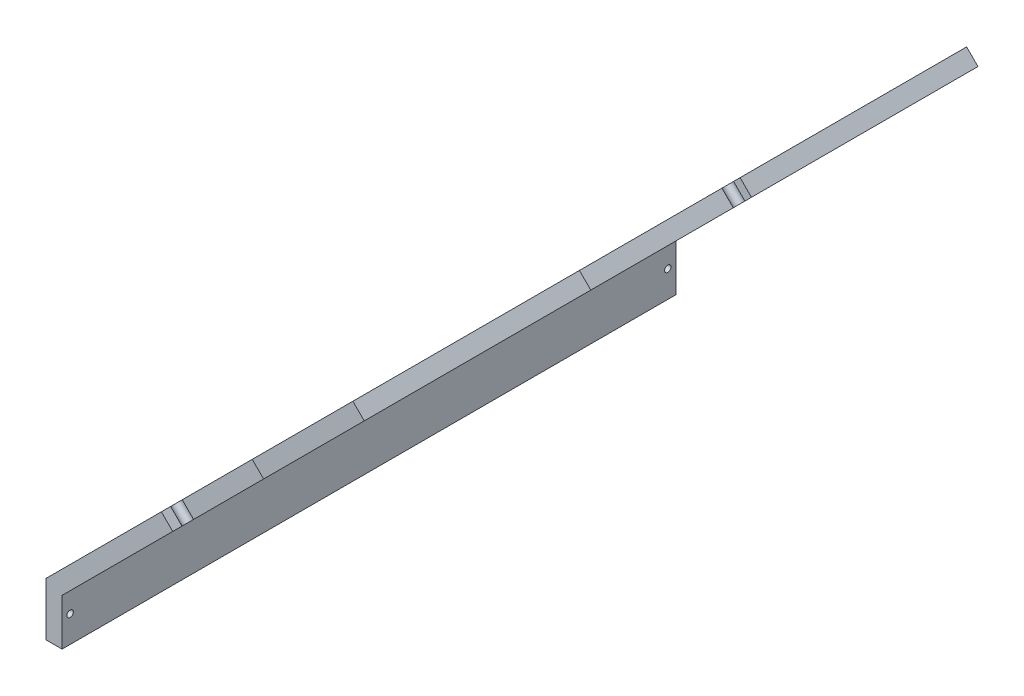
SolidWorks part; units mm, degrees
ref_plane "Plan de face" through (0, 0, 0) normal (0, 0, 1) x (1, 0, 0)
ref_plane "Plan de dessus" through (0, 0, 0) normal (0, 1, 0) x (1, 0, 0)
ref_plane "Plan de droite" through (0, 0, 0) normal (1, 0, 0) x (0, 0, -1)
sketch "Esquisse1" plane through (0, 0, 0) normal (0, 0, 1) x (1, 0, 0)
  line L0 (0, 0) -> (-5, 0)
  line L1 (-5, 0) -> (-5, 16.5711)
  line L2 (-5, 16.5711) -> (90.5026, 112.0737)
  line L3 (90.5026, 112.0737) -> (94.0381, 108.5381)
  line L4 (94.0381, 108.5381) -> (0, 14.5)
  line L5 (0, 14.5) -> (0, 0)
  dimension "D1" = 5
  dimension "D2" = 5
  dimension "D3" = 135
  dimension "D4" = 14.5
  dimension "D5" = 132.99
extrude "Boss.-Extru.1" add sketch "Esquisse1" along normal blind 191
sketch "Esquisse2" plane through (-10.7855, 10.7855, 0) normal (-0.7071, 0.7071, 0) x (0, 0, 1)
  line L0 (0, 143.243) -> (0, 8.182) construction
  line L1 (2.8787, 98.9465) -> (0, 98.9465)
  line L2 (5, 96.8252) -> (5, 61.0678)
  line L3 (2.8787, 58.9465) -> (0, 58.9465)
  line L4 (0, 98.9465) -> (0, 58.9465)
  line L5 (0, 58.9465) -> (5, 58.9465) construction
  line L7 (191, 143.243) -> (0, 143.243) construction
  line L8 (72.6213, 138.2394) -> (118.3787, 138.2394)
  line L9 (70.5, 140.3607) -> (70.5, 143.243)
  line L10 (70.5, 143.243) -> (120.5, 143.243)
  line L11 (191, 143.243) -> (191, 8.182) construction
  line L12 (191, 98.9465) -> (188.1213, 98.9465)
  line L13 (191, 98.9465) -> (191, 58.9465)
  line L14 (191, 58.9465) -> (188.1213, 58.9465)
  line L15 (186, 96.8252) -> (186, 61.0678)
  line L16 (186, 98.9465) -> (191, 98.9465) construction
  line L17 (120.5, 140.3607) -> (120.5, 143.243)
  line L18 (5, 98.9465) -> (-17.4078, 76.5387) construction
  line L19 (5, 58.9465) -> (-10.4338, 74.3803) construction
  line L20 (186, 98.9465) -> (201.6758, 83.2707) construction
  line L21 (186, 58.9465) -> (201.4387, 74.3852) construction
  line L22 (120.5, 138.2394) -> (93.259, 165.4804) construction
  line L23 (70.5, 138.2394) -> (86.6752, 154.4146) construction
  line L24 (5, 98.9465) -> (0, 143.243) construction
  line L25 (0, 143.243) -> (-0.2606, 142.9726) construction
  line L26 (-0.2606, 142.9726) -> (70.5, 138.2394) construction
  line L27 (191, 143.243) -> (120.5, 138.2394) construction
  line L28 (191, 143.243) -> (186, 98.9465) construction
  line L29 (186, 58.9465) -> (191, 8.182) construction
  line L30 (5, 58.9465) -> (0, 8.182) construction
  arc A0 (70.5, 140.3607) -> (72.6213, 138.2394) centre (71.5607, 139.3) ccw
  arc A1 (118.3787, 138.2394) -> (120.5, 140.3607) centre (119.4393, 139.3) ccw
  arc A2 (188.1213, 98.9465) -> (186, 96.8252) centre (187.0607, 97.8858) ccw
  arc A3 (186, 61.0678) -> (188.1213, 58.9465) centre (187.0607, 60.0071) ccw
  arc A4 (5, 96.8252) -> (2.8787, 98.9465) centre (3.9393, 97.8858) ccw
  arc A5 (2.8787, 58.9465) -> (5, 61.0678) centre (3.9393, 60.0071) ccw
  circle A6 centre (35.1197, 140.606) radius 1
  circle A7 centre (2.5, 121.0948) radius 1
  circle A8 centre (155.75, 140.7412) radius 1
  circle A9 centre (188.5, 121.0948) radius 1
  circle A10 centre (188.5, 33.5642) radius 1
  circle A11 centre (2.5, 33.5642) radius 1
  dimension "D1" = 45
  dimension "D2" = 45
  dimension "D3" = 45
  dimension "D4" = 45
  dimension "D5" = 45
  dimension "D6" = 45
extrude "Enlèv. mat.-Extru.1" cut sketch "Esquisse2" against normal blind 5
sketch "Esquisse4" plane through (-5, 0, 0) normal (-1, 0, 0) x (0, 0, 1)
  line L0 (0, 0) -> (5, 16.5711) construction
  line L1 (191, 16.5711) -> (0, 16.5711) construction
  line L2 (186, 16.5711) -> (191, 0) construction
  circle A0 centre (2.5, 8.2855) radius 1
  circle A1 centre (188.5, 8.2855) radius 1
  dimension "D1" = 5
  dimension "D2" = 5
extrude "Enlèv. mat.-Extru.2" cut sketch "Esquisse4" against normal blind 10
